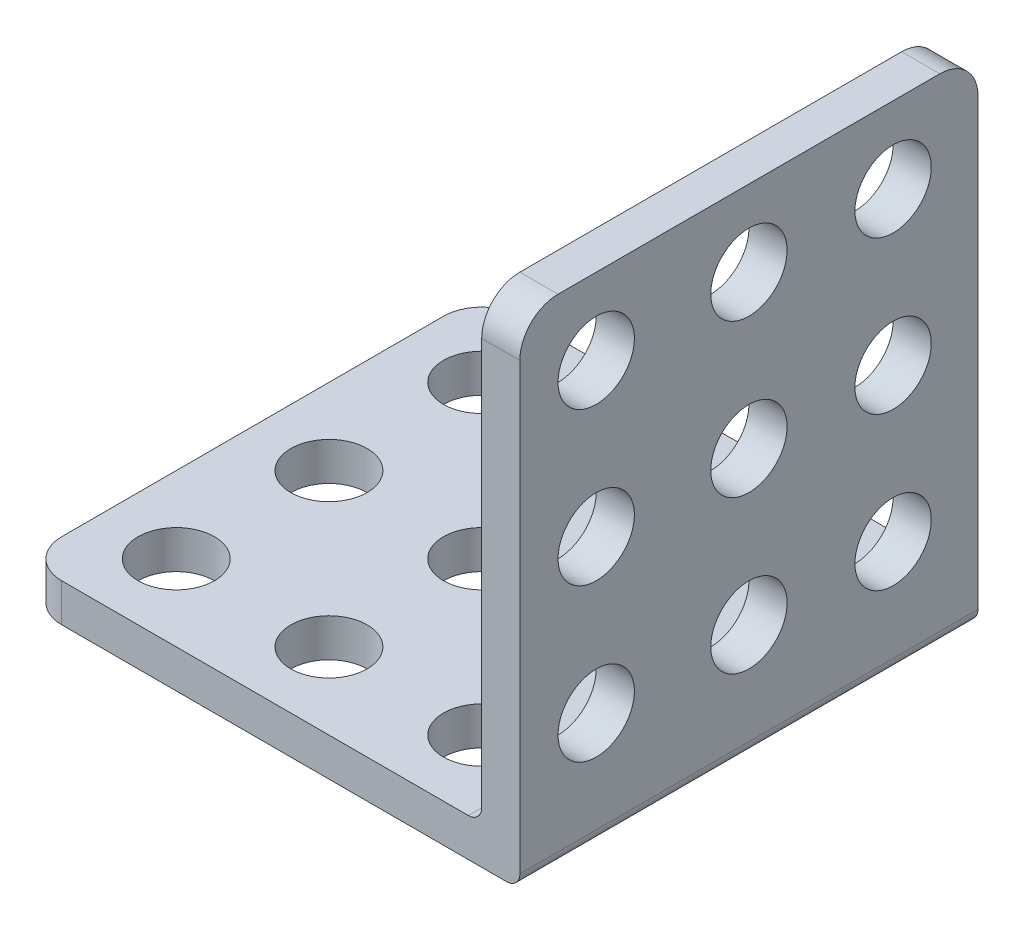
SolidWorks part; units mm, degrees
ref_plane "前视基准面" through (0, 0, 0) normal (0, 0, 1) x (1, 0, 0)
ref_plane "上视基准面" through (0, 0, 0) normal (0, 1, 0) x (1, 0, 0)
ref_plane "右视基准面" through (0, 0, 0) normal (1, 0, 0) x (0, 0, -1)
sketch "草图1" plane through (0, 0, 0) normal (0, 1, 0) x (1, 0, 0)
  line L1 (0, 0) -> (26, 0)
  line L2 (0, 0) -> (0, -24)
  line L3 (0, -24) -> (26, -24)
  line L4 (26, 0) -> (26, -24)
  dimension "D1" = 26
  dimension "D2" = 24
extrude "凸台-拉伸1" add sketch "草图1" along normal blind 2
sketch "草图2" plane through (0, 2, 0) normal (0, 1, 0) x (1, 0, 0)
  line L0 (26, 0) -> (24, 0) construction
  line L1 (26, 0) -> (0, 0) construction
  line L3 (24, 0) -> (26, 0)
  line L4 (24, 0) -> (24, -24)
  line L5 (24, -24) -> (26, -24)
  line L6 (26, 0) -> (26, -24)
  dimension "D1" = 2
sketch "草图5" plane through (0, 2, 0) normal (0, 1, 0) x (1, 0, 0)
  line L0 (0, -12) -> (1, -12) construction
  line L1 (0, 0) -> (0, -24) construction
  line L2 (2, -12) -> (4, -12) construction
  line L3 (4, -14) -> (4, -18) construction
  line L4 (4, -18) -> (4, -20) construction
  line L5 (0, -24) -> (26, -24) construction
  line L6 (4, -10) -> (4, 0) construction
  line L7 (26, 0) -> (0, 0) construction
  line L8 (4, 0) -> (4, -2) construction
  line L9 (4, -2) -> (4, -4) construction
  circle A0 centre (4, -12) radius 2
  circle A1 centre (4, -20) radius 2
  circle A2 centre (4, -4) radius 2
  circle A3 centre (12, -12) radius 2
  circle A4 centre (12, -4) radius 2
  circle A5 centre (12, -20) radius 2
  circle A6 centre (20, -12) radius 2
  circle A7 centre (20, -4) radius 2
  circle A8 centre (20, -20) radius 2
  dimension "D4" = 4
  dimension "D7" = 6
  dimension "D8" = 4
  dimension "D1" = 1
  dimension "D2" = 2
  dimension "D3" = 4
  dimension "D5" = 2
  dimension "D6" = 2
  dimension "D9" = 3
extrude "切除-拉伸4" cut sketch "草图5" against normal through all contours A0 | A3 | A4 | A7 | A6 | A8 | A5 | A1 | A2
extrude "凸台-拉伸4" add sketch "草图2" along normal blind 24 contours L4 L5 L6 L3
sketch "草图7" plane through (24, 0, 0) normal (-1, 0, 0) x (0, 0, 1)
  line L0 (12, 26) -> (12, 24) construction
  line L1 (0, 26) -> (24, 26) construction
  line L2 (12, 24) -> (12, 22) construction
  circle A0 centre (12, 22) radius 2
  dimension "D1" = 2
  dimension "D2" = 2
sketch "草图8" plane through (24, 0, 0) normal (-1, 0, 0) x (0, 0, 1)
  line L0 (12, 22) -> (53.4467, 22) construction
  line L1 (6.4467, 22) -> (53.4467, 22) construction
  line L2 (6.4467, 22) -> (4.4467, 22) construction
  line L3 (12, 22) -> (18, 22) construction
  line L4 (18, 22) -> (20, 22) construction
  circle A0 centre (4.4467, 22) radius 2
  circle A1 centre (20, 22) radius 2
  dimension "D1" = 47
  dimension "D2" = 2
  dimension "D3" = 6
  dimension "D4" = 2
extrude "切除-拉伸5" cut sketch "草图8" against normal through all contours A0 | A1
pattern_linear "阵列(线性)1" count 2 spacing 8 along (0, 0, -1) of "切除-拉伸5"
pattern_linear "阵列(线性)2" count 3 spacing 8 along (0, -1, 0) of "阵列(线性)1", "切除-拉伸5"
fillet "圆角1" radius 2 4 edges at (25, 26, 24) (25, 26, 0) (0, 1, 0) (0, 1, 24)
fillet "圆角3" radius 0.7 2 edges at (26, 0, 12) (24, 2, 12)
